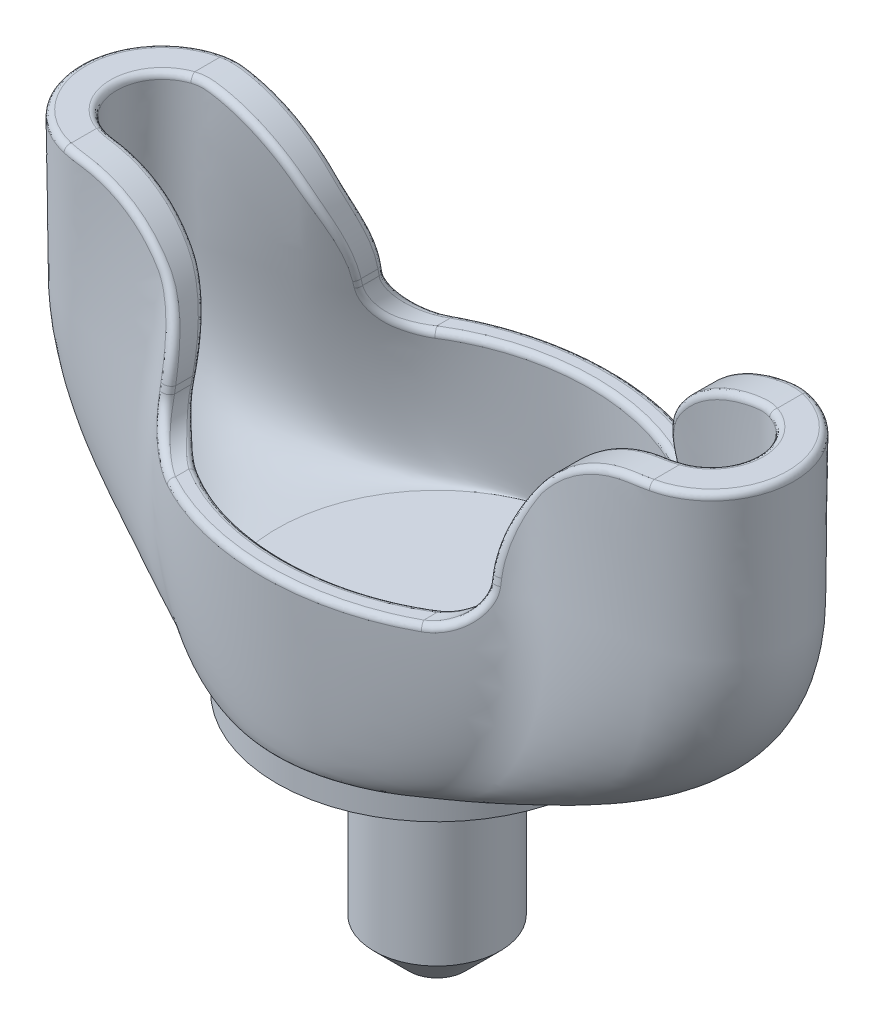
SolidWorks part; units mm, degrees
ref_plane "Front Plane" through (0, 0, 0) normal (0, 0, 1) x (1, 0, 0)
ref_plane "Top Plane" through (0, 0, 0) normal (0, 1, 0) x (1, 0, 0)
ref_plane "Right Plane" through (0, 0, 0) normal (1, 0, 0) x (0, 0, -1)
other "Configuration Table"
sketch "Sketch1" plane through (0, 0, 0) normal (0, 0, 1) x (1, 0, 0)
  line L0 (0, 10.7344) -> (0, -7.5424) construction
  line L1 (4.445, 5.334) -> (4.445, 6.5193)
  line L2 (-4.445, 0) -> (4.445, 0)
  line L3 (9.906, 10.16) -> (8.0857, 10.16)
  line L4 (-4.445, 5.334) -> (4.445, 5.334)
  line L5 (9.906, 10.16) -> (8.3762, 10.16) construction
  line L6 (9.906, 10.16) -> (9.906, 5.7504) construction
  line L7 (9.906, 10.16) -> (9.906, 6.1278)
  line L8 (4.445, 0) -> (4.445, 0.6667)
  line L9 (4.445, 0.6667) -> (0.3077, 0.6667) construction
  line L10 (-4.445, 0) -> (-4.445, 0.6667)
  line L11 (-9.906, 10.16) -> (-9.906, 6.1277)
  line L12 (-9.906, 10.16) -> (-8.0857, 10.16)
  line L13 (-4.445, 5.334) -> (-4.445, 6.5193)
  arc A5 (8.0857, 10.16) -> (4.445, 6.5193) centre (8.0857, 6.5193) ccw
  arc A6 (4.445, 0.6667) -> (9.906, 6.1278) centre (4.445, 6.1277) ccw
  arc A7 (-8.0857, 10.16) -> (-4.445, 6.5193) centre (-8.0857, 6.5193) cw
  arc A8 (-4.445, 0.6667) -> (-9.906, 6.1277) centre (-4.445, 6.1277) cw
  point P4 (0, 5.334)
  point P19 (0, 0)
ref_plane "Plane4" through (0, 10.16, 0) normal (0, 1, 0) x (-1, 0, 0)
ref_plane "Plane5" through (0, 0.6667, 0) normal (0, 1, 0) x (-1, 0, 0)
sketch "Sketch2" plane through (0, 10.16, 0) normal (0, 1, 0) x (-1, 0, 0)
  line L0 (4.445, 0) -> (-4.445, 0) construction
  line L1 (5.1243, -2.286) -> (7.62, -2.286)
  line L2 (0, 0) -> (14.2067, 0) construction
  line L3 (5.1243, 2.286) -> (7.62, 2.286)
  line L4 (0, 0) -> (0, 10.869) construction
  line L5 (0, 0) -> (0, -9.6836) construction
  line L6 (-5.1243, 2.286) -> (-7.62, 2.286)
  line L7 (-5.1243, -2.286) -> (-7.62, -2.286)
  arc A0 (4.2702, 2.7517) -> (-4.2702, 2.7517) centre (0, 0) ccw
  arc A1 (7.62, 2.286) -> (7.62, -2.286) centre (7.62, 0) cw
  arc A2 (-4.2702, -2.7517) -> (4.2702, -2.7517) centre (0, 0) ccw
  arc A3 (-7.62, 2.286) -> (-7.62, -2.286) centre (-7.62, 0) ccw
  arc A4 (-5.1243, 2.286) -> (-4.2702, 2.7517) centre (-5.1243, 3.302) ccw
  arc A5 (-5.1243, -2.286) -> (-4.2702, -2.7517) centre (-5.1243, -3.302) cw
  arc A6 (5.1243, 2.286) -> (4.2702, 2.7517) centre (5.1243, 3.302) cw
  arc A7 (5.1243, -2.286) -> (4.2702, -2.7517) centre (5.1243, -3.302) ccw
  point P20 (-4.5366, 2.286)
  point P23 (-4.5366, -2.286)
  point P26 (4.5366, 2.286)
  point P29 (4.5366, -2.286)
  dimension "F" = 10.16
  dimension "C" = 4.572
sketch "Sketch9" plane through (0, 0, 0) normal (0, 0, 1) x (1, 0, 0)
  line L0 (-9.906, 10.16) -> (-9.906, 6.1277) construction
  line L1 (-9.906, 10.16) -> (-9.906, 6.1277)
  arc A0 (-9.906, 6.1277) -> (-4.445, 0.6667) centre (-4.445, 6.1277) ccw construction
  arc A2 (-9.906, 6.1277) -> (-4.445, 0.6667) centre (-4.445, 6.1277) ccw
sketch "Sketch10" plane through (0, 0, 0) normal (0, 0, 1) x (1, 0, 0)
  line L0 (9.906, 10.16) -> (9.906, 6.1277) construction
  line L1 (9.906, 10.16) -> (9.906, 6.1277)
  arc A1 (4.445, 0.6668) -> (9.906, 6.1277) centre (4.445, 6.1277) ccw construction
  arc A2 (4.445, 0.6668) -> (9.906, 6.1277) centre (4.445, 6.1277) ccw
sketch "Sketch18" plane through (0, 0.6667, 0) normal (0, 1, 0) x (-1, 0, 0)
  circle A0 centre (0, 0) radius 4.445
loft "Loft2" add profiles "Sketch18", "Sketch2"
ref_plane "Plane6" through (0, 1.6827, 0) normal (0, 1, 0) x (-1, 0, 0)
sketch "Sketch20" plane through (0, 1.6827, 0) normal (0, 1, 0) x (-1, 0, 0)
  circle A0 centre (0, 0) radius 4.445 construction
  circle A1 centre (0, 0) radius 4.445
sketch "Sketch21" plane through (0, 10.16, 0) normal (0, 1, 0) x (-1, 0, 0)
  line L8 (-5.1243, 1.27) -> (-7.62, 1.27)
  line L9 (-7.62, -1.27) -> (-5.1243, -1.27)
  line L10 (5.1243, -1.27) -> (7.62, -1.27)
  line L11 (7.62, 1.27) -> (5.1243, 1.27)
  line L12 (-5.1243, 1.27) -> (-7.62, 1.27)
  line L13 (-7.62, -1.27) -> (-5.1243, -1.27)
  line L14 (5.1243, -1.27) -> (7.62, -1.27)
  line L15 (7.62, 1.27) -> (5.1243, 1.27)
  arc A16 (-7.62, 1.27) -> (-7.62, -1.27) centre (-7.62, 0) ccw
  arc A17 (-3.4162, -2.2013) -> (-5.1243, -1.27) centre (-5.1243, -3.302) ccw
  arc A18 (-3.4162, -2.2013) -> (3.4162, -2.2013) centre (0, 0) ccw
  arc A19 (5.1243, -1.27) -> (3.4162, -2.2013) centre (5.1243, -3.302) ccw
  arc A20 (7.62, -1.27) -> (7.62, 1.27) centre (7.62, 0) ccw
  arc A21 (3.4162, 2.2013) -> (5.1243, 1.27) centre (5.1243, 3.302) ccw
  arc A22 (3.4162, 2.2013) -> (-3.4162, 2.2013) centre (0, 0) ccw
  arc A23 (-5.1243, 1.27) -> (-3.4162, 2.2013) centre (-5.1243, 3.302) ccw
  arc A24 (-7.62, 1.27) -> (-7.62, -1.27) centre (-7.62, 0) ccw
  arc A25 (-3.4162, -2.2013) -> (-5.1243, -1.27) centre (-5.1243, -3.302) ccw
  arc A26 (-3.4162, -2.2013) -> (3.4162, -2.2013) centre (0, 0) ccw
  arc A27 (5.1243, -1.27) -> (3.4162, -2.2013) centre (5.1243, -3.302) ccw
  arc A28 (7.62, -1.27) -> (7.62, 1.27) centre (7.62, 0) ccw
  arc A29 (3.4162, 2.2013) -> (5.1243, 1.27) centre (5.1243, 3.302) ccw
  arc A30 (3.4162, 2.2013) -> (-3.4162, 2.2013) centre (0, 0) ccw
  arc A31 (-5.1243, 1.27) -> (-3.4162, 2.2013) centre (-5.1243, 3.302) ccw
sketch "Sketch22" plane through (0, 0, 0) normal (0, 0, 1) x (1, 0, 0)
  line L2 (-8.89, 10.16) -> (-8.89, 6.1277)
  line L3 (-8.89, 10.16) -> (-8.89, 6.1277)
  arc A2 (-8.89, 6.1277) -> (-4.445, 1.6827) centre (-4.445, 6.1277) ccw
  arc A3 (-8.89, 6.1277) -> (-4.445, 1.6827) centre (-4.445, 6.1277) ccw
sketch "Sketch23" plane through (0, 0, 0) normal (0, 0, 1) x (1, 0, 0)
  line L2 (8.89, 10.16) -> (8.89, 6.1277)
  line L3 (8.89, 10.16) -> (8.89, 6.1277)
  arc A2 (4.445, 1.6828) -> (8.89, 6.1277) centre (4.445, 6.1277) ccw
  arc A3 (4.445, 1.6828) -> (8.89, 6.1277) centre (4.445, 6.1277) ccw
loft "Cut-Loft1" cut profiles "Sketch20", "Sketch21"
sketch "Sketch14" plane through (0, 0, 0) normal (0, 0, 1) x (1, 0, 0)
  line L0 (0, 0) -> (0, -9.7552) construction
  line L2 (0, 0) -> (0, -6.35)
  line L3 (0, -6.35) -> (1.7526, -6.35)
  line L4 (1.7526, 0) -> (1.7526, -6.35)
  line L5 (1.7526, 0) -> (4.445, 0)
  line L6 (4.445, 0) -> (4.445, 0.6667)
  line L7 (4.445, 0.6667) -> (0, 0.6667)
  line L8 (0, 10.7344) -> (0, -7.5424) construction
  line L9 (6.9245, 0.6667) -> (-6.9245, 0.6667) construction
  line L10 (0, 0.6667) -> (0, 0)
revolve "Revolve1" add sketch "Sketch14" angle 360 about L0
sketch "Sketch16" plane through (0, 0, 0) normal (0, 0, 1) x (1, 0, 0)
  line L0 (-9.906, 10.16) -> (-9.906, 11.16)
  line L1 (-9.906, 11.16) -> (9.906, 11.16)
  line L2 (9.906, 11.16) -> (9.906, 10.16)
  line L10 (-4.445, 0) -> (4.445, 0)
  line L11 (4.445, 0) -> (4.445, 0.6667)
  line L12 (9.906, 6.1277) -> (9.906, 10.16)
  line L13 (9.906, 10.16) -> (8.0857, 10.16)
  line L14 (4.445, 6.5193) -> (4.445, 5.334)
  line L15 (4.445, 5.334) -> (-4.445, 5.334)
  line L16 (-4.445, 5.334) -> (-4.445, 6.5193)
  line L17 (-8.0857, 10.16) -> (-9.906, 10.16)
  line L18 (-9.906, 10.16) -> (-9.906, 6.1277)
  line L19 (-4.445, 0.6667) -> (-4.445, 0)
  line L23 (9.906, 10.16) -> (8.0857, 10.16)
  line L24 (4.445, 6.5193) -> (4.445, 5.334)
  line L25 (4.445, 5.334) -> (-4.445, 5.334)
  line L26 (-4.445, 5.334) -> (-4.445, 6.5193)
  line L27 (-8.0857, 10.16) -> (-9.906, 10.16)
  arc A4 (4.445, 0.6667) -> (9.906, 6.1277) centre (4.445, 6.1277) ccw
  arc A5 (8.0857, 10.16) -> (4.445, 6.5193) centre (8.0857, 6.5193) ccw
  arc A6 (-4.445, 6.5193) -> (-8.0857, 10.16) centre (-8.0857, 6.5193) ccw
  arc A7 (-9.906, 6.1277) -> (-4.445, 0.6667) centre (-4.445, 6.1277) ccw
  arc A9 (8.0857, 10.16) -> (4.445, 6.5193) centre (8.0857, 6.5193) ccw
  arc A10 (-4.445, 6.5193) -> (-8.0857, 10.16) centre (-8.0857, 6.5193) ccw
  dimension "D2" = 1
  dimension "D1" = 0
extrude "Cut-Extrude1" cut sketch "Sketch16" against normal through all and the other way through all
fillet "Fillet1" radius 1 4 edges at (4.445, 5.334, -2.924) (4.445, 5.334, 2.924) (-4.445, 5.334, -2.924) (-4.445, 5.334, 2.924)
fillet "Fillet2" radius 0.1693 32 edges at (-5.4656, 9.0471, -1.4153) (-5.968, 9.4808, 1.3386) (-4.1482, 5.623, -2.6418) (0.7192, 5.334, -4.1865) (4.2763, 5.7781, -2.5192) (5.4656, 9.0471, 1.4153) (5.968, 9.4808, -1.3386) (4.1482, 5.623, 2.6418) (-0.7192, 5.334, 4.1865) (-4.2763, 5.7781, 2.5192) (-5.3715, 8.9458, 2.3716) (-5.3444, 8.9152, -2.375) (-4.2761, 5.7779, -3.4455) (1.9112, 5.334, -4.5997) (4.1338, 5.609, -3.5649) (5.3444, 8.9152, 2.375) (5.3715, 8.9458, -2.3716) (4.2761, 5.7779, 3.4455) (-1.9112, 5.334, 4.5997) (-4.1338, 5.609, 3.5649)
sketch "Sketch27" plane through (0, 0, 0) normal (0, 0, 1) x (1, 0, 0)
  line L0 (0, 0) -> (0, -9.1725) construction
  line L1 (-4.445, 0) -> (4.445, 0) construction
  line L2 (0.7747, -6.35) -> (0, -5.8845)
  line L3 (-1.7526, -6.35) -> (1.7526, -6.35) construction
  line L4 (0, -5.8845) -> (0, -6.604)
  line L5 (0, -6.604) -> (1.9279, -6.604)
  line L6 (1.9279, -6.604) -> (1.9279, -5.1968)
  line L7 (1.9279, -5.1968) -> (0.7747, -6.35)
revolve "Cut-Revolve11" cut sketch "Sketch27" angle 360 about L0
sketch "Sketch26" plane through (0, 0, 0) normal (0, 0, 1) x (1, 0, 0)
  line L0 (0, 0) -> (0, -6.8807) construction
  line L1 (-1.7526, 0) -> (1.7526, 0) construction
  line L2 (1.2802, -0.2753) -> (1.7526, -0.0025)
  line L3 (1.7526, -0.0025) -> (1.7526, -0.5481)
  line L4 (1.7526, -0.5481) -> (1.2802, -0.2753)
  line L9 (1.2802, -0.2753) -> (1.2802, -1.0678) construction
revolve "Cut-Revolve10" [suppressed] cut sketch "Sketch26" angle 360 about L0
pattern_linear "LPattern10" [suppressed] count 8 along (0, -1, 0)
equation "\"D1@Sketch1\" = (  \"A@Sketch1\" - \"EE@Sketch1\"  ) / 2 / 3"
equation "\"D2@Sketch1\" = \"G@Sketch1\" / 8"
equation "\"D1@LPattern10\" =\"L@Sketch14\" / \"pitch@Sketch26\" "
equation "\"EE@Sketch1\" = \"E@Sketch1\""
equation "\"LL@Cosmetic Thread1\" = \"L@Sketch14\""
equation "\"D3@Sketch27\" = \"d1@Sketch14\" * 1.1 / 2"
equation "\"D1@Fillet2\" = \"T\" / 6"
equation "\"D1@Sketch26\" = \"d1@Sketch14\""
equation "\"D2@Sketch26\" = \"THD_MINOR@Cosmetic Thread1\""
equation "\"PITCH@LPattern10\" = \"pitch@Sketch26\""
